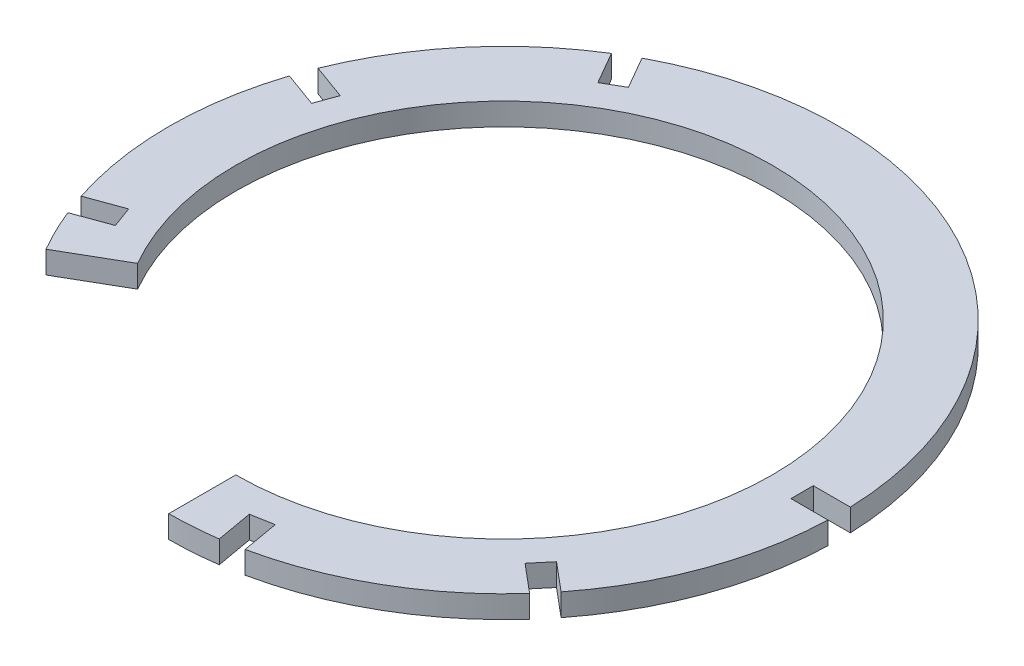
SolidWorks part; units mm, degrees
ref_plane "Front Plane" through (0, 0, 0) normal (0, 0, 1) x (1, 0, 0)
ref_plane "Top Plane" through (0, 0, 0) normal (0, 1, 0) x (1, 0, 0)
ref_plane "Right Plane" through (0, 0, 0) normal (1, 0, 0) x (0, 0, -1)
sketch "Sketch1" plane through (0, 0, 0) normal (0, 1, 0) x (1, 0, 0)
  line L0 (0, 0) -> (300.0289, 0) construction
  line L1 (-155.8846, -90) -> (-194.8557, -112.5)
  line L2 (0, -180) -> (0, -225)
  arc A0 (0, -225) -> (-194.8557, -112.5) centre (0, 0) ccw
  arc A1 (0, -180) -> (-155.8846, -90) centre (0, 0) ccw
  dimension "D1" = 225
  dimension "D2" = 180
  dimension "D3" = 210
  dimension "D4" = 60
extrude "Boss-Extrude1" add sketch "Sketch1" along normal blind 15 contours A0
sketch "Sketch2" plane through (0, 15, 0) normal (0, 1, 0) x (1, 0, 0)
  line L0 (0, 0) -> (225, 0) construction
  line L1 (200, 7.5) -> (250, 7.5)
  line L2 (95, 7.5) -> (150, 7.5)
  line L3 (95, 7.5) -> (95, -7.5)
  line L4 (95, -7.5) -> (150, -7.5)
  line L5 (150, 7.5) -> (150, -7.5)
  line L6 (200, 7.5) -> (200, -7.5)
  line L7 (200, -7.5) -> (250, -7.5)
  line L8 (42.1157, -195.6592) -> (50.7981, -244.8996)
  line L9 (23.8826, -92.2544) -> (33.4333, -146.4188)
  line L10 (23.8826, -92.2544) -> (9.1105, -94.8591)
  line L11 (9.1105, -94.8591) -> (18.6612, -149.0235)
  line L12 (33.4333, -146.4188) -> (18.6612, -149.0235)
  line L13 (42.1157, -195.6592) -> (27.3436, -198.2639)
  line L14 (27.3436, -198.2639) -> (36.026, -247.5043)
  line L15 (158.0298, -122.8122) -> (196.332, -154.9516)
  line L16 (77.5951, -55.3195) -> (119.7276, -90.6728)
  line L17 (77.5951, -55.3195) -> (67.9533, -66.8102)
  line L18 (67.9533, -66.8102) -> (110.0858, -102.1635)
  line L19 (119.7276, -90.6728) -> (110.0858, -102.1635)
  line L20 (158.0298, -122.8122) -> (148.388, -134.3029)
  line L21 (148.388, -134.3029) -> (186.6902, -166.4422)
  line L22 (186.6902, -166.4422) -> (196.332, -154.9516)
  line L23 (0, 0) -> (39.0708, -221.5817) construction
  line L24 (-93.5048, -176.9551) -> (-118.5048, -220.2564)
  line L25 (-41.0048, -86.0224) -> (-68.5048, -133.6538)
  line L26 (-41.0048, -86.0224) -> (-53.9952, -78.5224)
  line L27 (36.026, -247.5043) -> (50.7981, -244.8996)
  line L28 (-131.4952, -212.7564) -> (-118.5048, -220.2564)
  line L29 (0, 0) -> (172.36, -144.6272) construction
  line L30 (-53.9952, -78.5224) -> (-81.4952, -126.1538)
  line L31 (-68.5048, -133.6538) -> (-81.4952, -126.1538)
  line L32 (-93.5048, -176.9551) -> (-106.4952, -169.4551)
  line L33 (-106.4952, -169.4551) -> (-131.4952, -212.7564)
  line L34 (0, 0) -> (-112.5, -194.8557) construction
  line L35 (-185.3734, -75.4517) -> (-232.358, -92.5527)
  line L36 (-86.7056, -39.5396) -> (-138.3887, -58.3507)
  line L37 (-86.7056, -39.5396) -> (-91.836, -25.4442)
  line L38 (-91.836, -25.4442) -> (-143.519, -44.2553)
  line L39 (-138.3887, -58.3507) -> (-143.519, -44.2553)
  line L40 (-185.3734, -75.4517) -> (-190.5037, -61.3563)
  line L41 (-190.5037, -61.3563) -> (-237.4883, -78.4573)
  line L42 (0, 0) -> (-211.4308, -76.9545) construction
  line L43 (-190.5037, 61.3563) -> (-237.4883, 78.4573)
  line L44 (-91.836, 25.4442) -> (-143.519, 44.2553)
  line L45 (-91.836, 25.4442) -> (-86.7056, 39.5396)
  line L46 (-86.7056, 39.5396) -> (-138.3887, 58.3507)
  line L47 (-143.519, 44.2553) -> (-138.3887, 58.3507)
  line L48 (-190.5037, 61.3563) -> (-185.3734, 75.4517)
  line L49 (-185.3734, 75.4517) -> (-232.358, 92.5527)
  line L50 (0, 0) -> (-211.4308, 76.9545) construction
  line L51 (250, -7.5) -> (250, 7.5)
  line L52 (-237.4883, -78.4573) -> (-232.358, -92.5527)
  line L53 (-232.358, 92.5527) -> (-237.4883, 78.4573)
  line L54 (-106.4952, 169.4551) -> (-131.4952, 212.7564)
  line L55 (-53.9952, 78.5224) -> (-81.4952, 126.1538)
  line L56 (-53.9952, 78.5224) -> (-41.0048, 86.0224)
  line L57 (-41.0048, 86.0224) -> (-68.5048, 133.6538)
  line L58 (-81.4952, 126.1538) -> (-68.5048, 133.6538)
  line L59 (-106.4952, 169.4551) -> (-93.5048, 176.9551)
  line L60 (-93.5048, 176.9551) -> (-118.5048, 220.2564)
  line L61 (0, 0) -> (-112.5, 194.8557) construction
  line L62 (-118.5048, 220.2564) -> (-131.4952, 212.7564)
  circle A0 centre (0, 0) radius 225 construction
  point P13 (-12.0777, 27.2748)
  dimension "D1" = 55
  dimension "D2" = 15
  dimension "D3" = 7.5
  dimension "D4" = 95
  dimension "D5" = 50
  dimension "D6" = 40
  dimension "D8" = 50
  dimension "D7" = 7
extrude "Cut-Extrude3" cut sketch "Sketch2" against normal blind 15 contours L7 L51 L1 L6 | L4 L5 L2 L3 | L21 L22 L15 L20 | L18 L19 L16 L17 | L8 L27 L14 L13 | L9 L12 L11 L10 | L25 L31 L30 L26 | L24 L28 L33 L32 | L35 L52 L41 L40 | L36 L39 L38 L37 | L44 L47 L46 L45 | L43 L53 L49 L48 | L55 L58 L57 L56 | L54 L62 L60 L59
